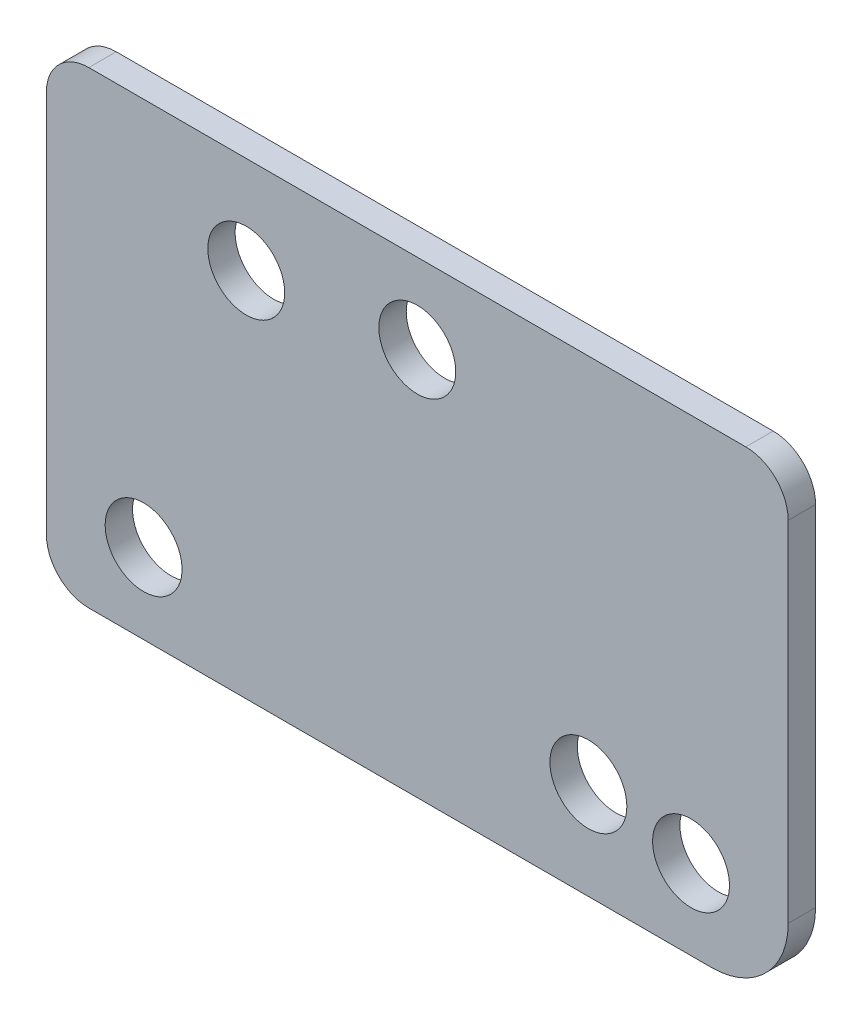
SolidWorks part; units mm, degrees
ref_plane "Front" through (0, 0, 0) normal (0, 0, 1) x (1, 0, 0)
ref_plane "Top" through (0, 0, 0) normal (0, 1, 0) x (1, 0, 0)
ref_plane "Right" through (0, 0, 0) normal (1, 0, 0) x (0, 0, -1)
ref_plane "Plane1"
sketch "Sketch1" plane through (0, 0, 82.1182) normal (0, 0, -1) x (-1, 0, 0)
  line L4 (902.4933, -48.7304) -> (902.4933, -13.1704)
  line L5 (898.0483, -8.7254) -> (837.0883, -8.7254)
  line L6 (832.6433, -13.1704) -> (832.6433, -45.5554)
  line L7 (840.2633, -53.1754) -> (898.0483, -53.1754)
  line L8 (902.4933, -48.7304) -> (902.4933, -13.1704)
  line L9 (898.0483, -8.7254) -> (837.0883, -8.7254)
  line L10 (832.6433, -13.1704) -> (832.6433, -45.5554)
  line L11 (840.2633, -53.1754) -> (898.0483, -53.1754)
  arc A4 (902.4933, -13.1704) -> (898.0483, -8.7254) centre (898.0483, -13.1704) ccw
  arc A5 (837.0883, -8.7254) -> (832.6433, -13.1704) centre (837.0883, -13.1704) ccw
  arc A6 (832.6433, -45.5554) -> (840.2633, -53.1754) centre (840.2633, -45.5554) ccw
  arc A7 (898.0483, -53.1754) -> (902.4933, -48.7304) centre (898.0483, -48.7304) ccw
  arc A8 (902.4933, -13.1704) -> (898.0483, -8.7254) centre (898.0483, -13.1704) ccw
  arc A9 (837.0883, -8.7254) -> (832.6433, -13.1704) centre (837.0883, -13.1704) ccw
  arc A10 (832.6433, -45.5554) -> (840.2633, -53.1754) centre (840.2633, -45.5554) ccw
  arc A11 (898.0483, -53.1754) -> (902.4933, -48.7304) centre (898.0483, -48.7304) ccw
sketch "Sketch2" plane through (0, 0, 82.1182) normal (0, 0, -1) x (-1, 0, 0)
  line L4 (901.9853, -48.7304) -> (901.9853, -13.1704)
  line L5 (898.0483, -9.2334) -> (837.0883, -9.2334)
  line L6 (833.1513, -13.1704) -> (833.1513, -45.5554)
  line L7 (840.2633, -52.6674) -> (898.0483, -52.6674)
  line L8 (901.9853, -48.7304) -> (901.9853, -13.1704)
  line L9 (898.0483, -9.2334) -> (837.0883, -9.2334)
  line L10 (833.1513, -13.1704) -> (833.1513, -45.5554)
  line L11 (840.2633, -52.6674) -> (898.0483, -52.6674)
  arc A4 (901.9853, -13.1704) -> (898.0483, -9.2334) centre (898.0483, -13.1704) ccw
  arc A5 (837.0883, -9.2334) -> (833.1513, -13.1704) centre (837.0883, -13.1704) ccw
  arc A6 (833.1513, -45.5554) -> (840.2633, -52.6674) centre (840.2633, -45.5554) ccw
  arc A7 (898.0483, -52.6674) -> (901.9853, -48.7304) centre (898.0483, -48.7304) ccw
  arc A8 (901.9853, -13.1704) -> (898.0483, -9.2334) centre (898.0483, -13.1704) ccw
  arc A9 (837.0883, -9.2334) -> (833.1513, -13.1704) centre (837.0883, -13.1704) ccw
  arc A10 (833.1513, -45.5554) -> (840.2633, -52.6674) centre (840.2633, -45.5554) ccw
  arc A11 (898.0483, -52.6674) -> (901.9853, -48.7304) centre (898.0483, -48.7304) ccw
extrude "Boss-Extrude1" add sketch "Sketch2" against normal blind 2.54 flip side to cut
hole_wizard "Hole1" positions "Point_Sketch" profile "Profil_Sketch" hole size "Ø0.15" standard "ISO"
sketch "Point_Sketch" plane through (-838.514, -34.6368, 82.1182) normal (0, 0, 1) x (-1, 0, 0)
  point P0 (3.6543, 10.6011)
  point P2 (54.4543, 10.6011)
  point P4 (29.0543, -17.9739)
sketch "Profil_Sketch" plane through (-842.1683, -45.2379, 82.1182) normal (1, 0, 0) x (0, 1, 0)
  line L0 (0, 0) -> (0, 2.54)
  line L1 (0, 2.54) -> (3.5687, 2.54)
  line L2 (3.5687, 2.54) -> (3.5687, 0)
  line L5 (3.5687, 0) -> (0, 0)
  line L11 (0, -6.35) -> (0, 107.95) construction
  dimension "Diameter" = 7.1374
  dimension "Thru Hole Depth" = 2.54
other "usin_DL090_.25-20x1.75-SHCS<1>"
hole_wizard "Hole11" positions "Point_Sketch1" profile "Profil_Sketch1" hole size "Ø0.15" standard "ISO"
sketch "Point_Sketch1" plane through (-855.3476, -33.0493, 84.6582) normal (0, 0, -1) x (1, 0, 0)
  point P0 (3.6543, 10.6011)
  point P2 (-28.0957, -14.7989)
sketch "Profil_Sketch1" plane through (-851.6933, -43.6504, 84.6582) normal (1, 0, 0) x (0, -1, 0)
  line L0 (0, 0) -> (0, 2.54)
  line L1 (0, 2.54) -> (3.5687, 2.54)
  line L2 (3.5687, 2.54) -> (3.5687, 0)
  line L5 (3.5687, 0) -> (0, 0)
  line L11 (0, -6.35) -> (0, 107.95) construction
  dimension "Diameter" = 7.1374
  dimension "Thru Hole Depth" = 2.54
other "usin_DL090_.25-20x.625-SHCS<2>"
